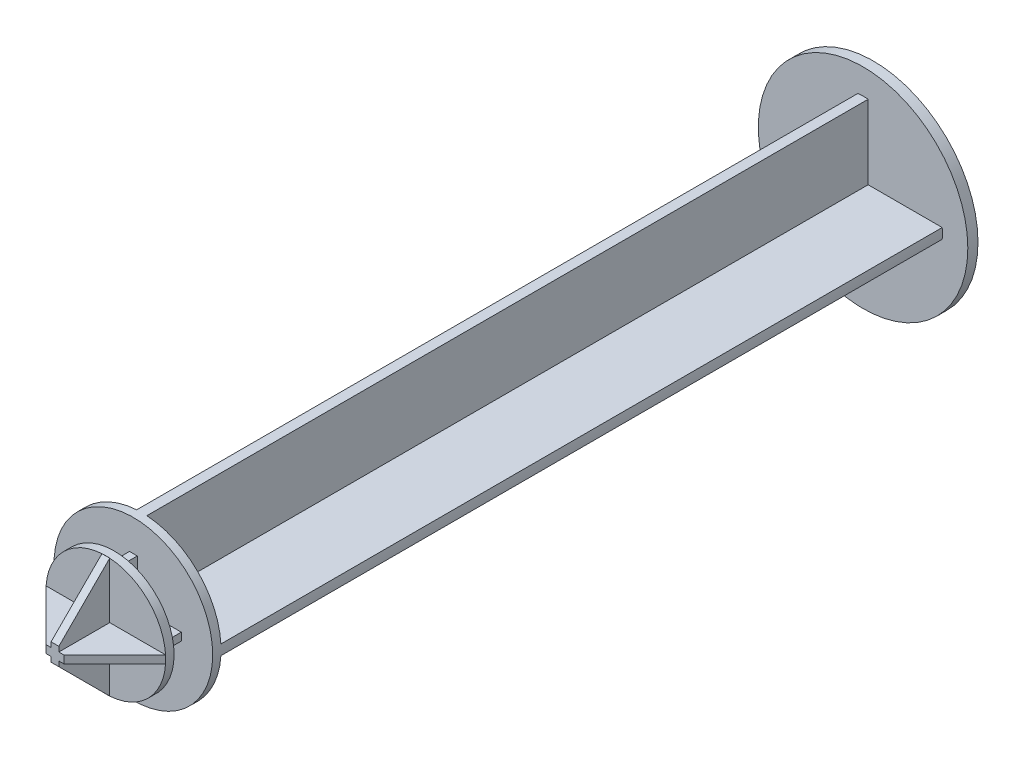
SolidWorks part; units mm, degrees
ref_plane "Face" through (0, 0, 0) normal (0, 0, 1) x (1, 0, 0)
ref_plane "Dessus" through (0, 0, 0) normal (0, 1, 0) x (1, 0, 0)
ref_plane "Droite" through (0, 0, 0) normal (1, 0, 0) x (0, 0, -1)
sketch "Esquisse1" plane through (0, 0, 0) normal (0, 0, 1) x (1, 0, 0)
  circle A0 centre (0, 0) radius 17.5
  dimension "D1" = 35
extrude " DISQUE 1" add sketch "Esquisse1" along normal blind 1.7
sketch "Esquisse2" plane through (0, 0, 1.7) normal (0, 0, 1) x (1, 0, 0)
  line L0 (0, 13.1081) -> (0, -17.5) construction
  line L1 (-14.0929, 0) -> (17.5, 0) construction
  line L2 (-0.85, 13.2227) -> (-0.85, 0.85)
  line L3 (0.85, 13.2227) -> (0.85, 0.85)
  line L4 (-13.2227, 0.85) -> (-0.85, 0.85)
  line L5 (-13.2227, -0.85) -> (-0.85, -0.85)
  line L6 (0.85, -0.85) -> (0.85, -13.2227)
  line L7 (0.85, -0.85) -> (13.2227, -0.85)
  line L8 (-0.85, -0.85) -> (-0.85, -13.2227)
  line L9 (0.85, 0.85) -> (13.2227, 0.85)
  arc A0 (13.2227, -0.85) -> (13.2227, 0.85) centre (0, 0) ccw
  circle A1 centre (0, 0) radius 17.5 construction
  arc A2 (-0.85, -13.2227) -> (0.85, -13.2227) centre (0, 0) ccw
  arc A3 (-13.2227, 0.85) -> (-13.2227, -0.85) centre (0, 0) ccw
  arc A4 (0.85, 13.2227) -> (-0.85, 13.2227) centre (0, 0) ccw
  dimension "D1" = 26.5
  dimension "D2" = 1.7
  dimension "D3" = 1.7
extrude "TIGE" add sketch "Esquisse2" along normal blind 120.5
sketch "Esquisse3" plane through (0, 0, 122.2) normal (0, 0, 1) x (1, 0, 0)
  circle A0 centre (0, 0) radius 13.25
  arc A1 (0.85, 13.2227) -> (-0.85, 13.2227) centre (0, 0) ccw construction
extrude "DISQUE 2" add sketch "Esquisse3" along normal blind 1.4
sketch "Esquisse4" plane through (0, 0, 123.6) normal (0, 0, 1) x (1, 0, 0)
  line L0 (-11.9195, 0) -> (13.8665, 0) construction
  line L1 (0, 12.361) -> (0, -12.6897) construction
  line L2 (-0.65, 8) -> (-0.65, 0.65)
  line L3 (0.65, 8) -> (0.65, 0.65)
  line L4 (-8, 0.65) -> (-0.65, 0.65)
  line L5 (-8, -0.65) -> (-0.65, -0.65)
  line L6 (-8, 0.65) -> (-8, -0.65)
  line L7 (-0.65, -8) -> (0.65, -8)
  line L8 (8, 0.65) -> (8, -0.65)
  line L9 (-0.65, 8) -> (0.65, 8)
  line L10 (0.65, 0.65) -> (8, 0.65)
  line L11 (-0.65, -0.65) -> (-0.65, -8)
  line L12 (0.65, -0.65) -> (8, -0.65)
  line L13 (0.65, -0.65) -> (0.65, -8)
  dimension "D1" = 1.3
  dimension "D2" = 16
extrude "CROIX 1" add sketch "Esquisse4" along normal blind 3.2
sketch "Esquisse5" plane through (0, 0, 126.8) normal (0, 0, 1) x (1, 0, 0)
  circle A0 centre (0, 0) radius 10
  dimension "D1" = 20
extrude "DISQUE 3" add sketch "Esquisse5" along normal blind 1.4
sketch "Esquisse6" plane through (0, 0, 128.2) normal (0, 0, 1) x (1, 0, 0)
  line L0 (-14.4324, 0) -> (18.3717, 0) construction
  line L1 (0, 12.4968) -> (0, -16.9114) construction
  line L2 (-0.65, 8) -> (-0.65, 0.65) construction
  line L3 (-0.65, 9.9789) -> (-0.65, 0.65)
  line L4 (0.65, 0.65) -> (0.65, 8) construction
  line L5 (0.65, 0.65) -> (0.65, 9.9789)
  line L6 (8, 0.65) -> (0.65, 0.65) construction
  line L7 (9.9789, 0.65) -> (0.65, 0.65)
  line L8 (0.65, -0.65) -> (8, -0.65) construction
  line L9 (0.65, -0.65) -> (9.9789, -0.65)
  line L10 (0.65, -8) -> (0.65, -0.65) construction
  line L11 (0.65, -9.9789) -> (0.65, -0.65)
  line L12 (-0.65, -0.65) -> (-0.65, -8) construction
  line L13 (-0.65, -0.65) -> (-0.65, -9.9789)
  line L14 (-8, -0.65) -> (-0.65, -0.65) construction
  line L15 (-9.9789, -0.65) -> (-0.65, -0.65)
  line L16 (-0.65, 0.65) -> (-8, 0.65) construction
  line L17 (-0.65, 0.65) -> (-9.9789, 0.65)
  line L18 (-0.65, 9.9789) -> (0.65, 9.9789)
  line L19 (9.9789, 0.65) -> (9.9789, -0.65)
  line L20 (-0.65, -9.9789) -> (0.65, -9.9789)
  line L21 (-9.9789, 0.65) -> (-9.9789, -0.65)
  circle A0 centre (0, 0) radius 10 construction
extrude "CROIX 2" add sketch "Esquisse6" along normal blind 8.5
draft "EMBOUT" type of draft neutral plane draft angle 45 faces to draft 4 parameters "D1"=45
